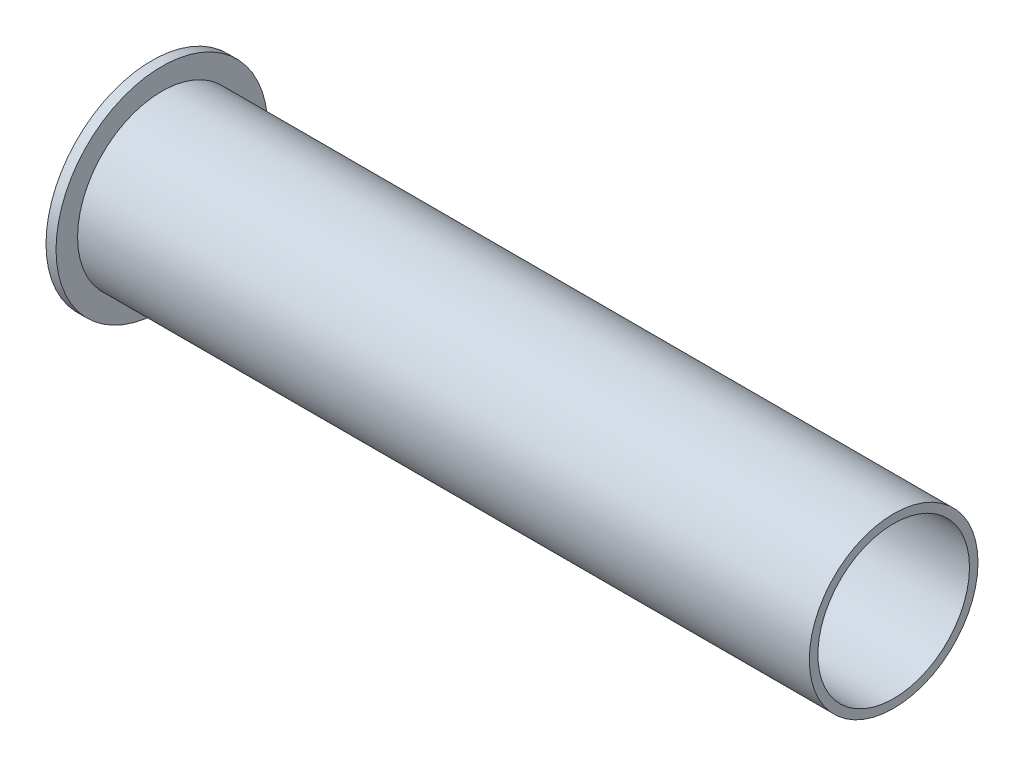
SolidWorks part; units mm, degrees
ref_plane "Front Plane" through (0, 0, 0) normal (0, 0, 1) x (1, 0, 0)
ref_plane "Top Plane" through (0, 0, 0) normal (0, 1, 0) x (1, 0, 0)
ref_plane "Right Plane" through (0, 0, 0) normal (1, 0, 0) x (0, 0, -1)
sketch "Sketch1" plane through (0, 0, 0) normal (1, 0, 0) x (0, 0, -1)
  circle A0 centre (0, 0) radius 5.7658
  circle A1 centre (0, 0) radius 6.4135
  dimension "D1" = 11.5316
  dimension "D2" = 12.827
extrude "Boss-Extrude1" add sketch "Sketch1" along normal blind 56.4134
sketch "Sketch2" plane through (0, 0, 0) normal (-1, 0, 0) x (0, 0, 1)
  circle A0 centre (0, 0) radius 5.7658 construction
  circle A1 centre (0, 0) radius 5.7658
  circle A2 centre (0, 0) radius 8.0518
  dimension "D1" = 2.286
extrude "Boss-Extrude2" add sketch "Sketch2" against normal blind 0.762
